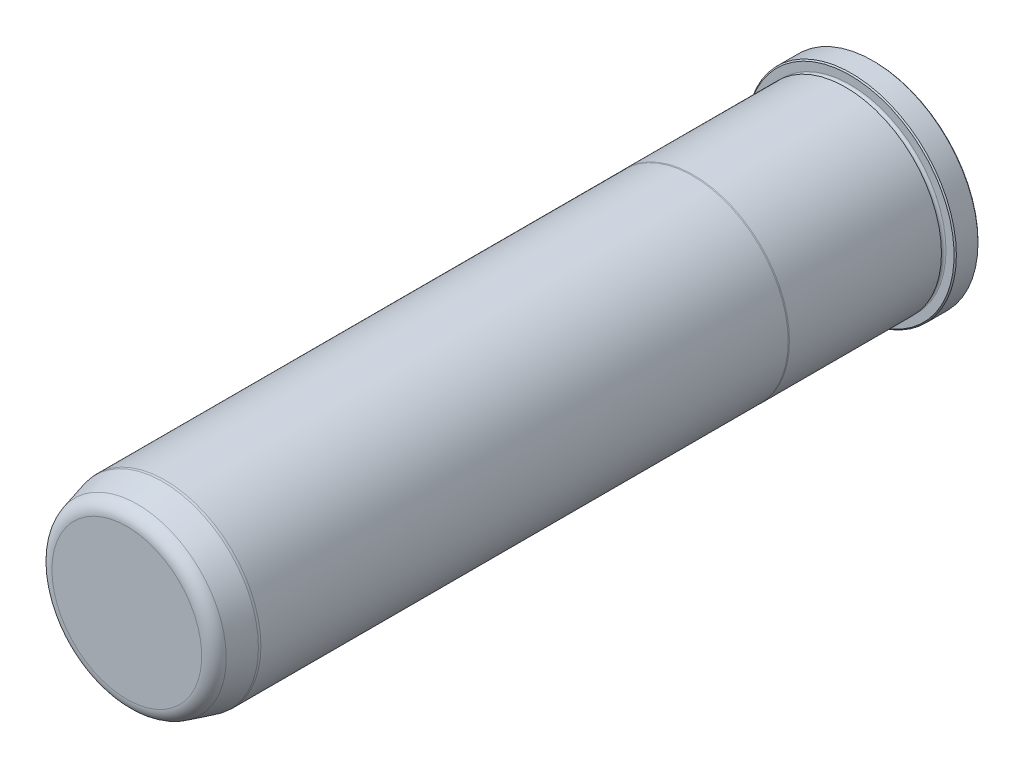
SolidWorks part; units mm, degrees
ref_plane "Front Plane" through (0, 0, 0) normal (0, 0, 1) x (1, 0, 0)
ref_plane "Top Plane" through (0, 0, 0) normal (0, 1, 0) x (1, 0, 0)
ref_plane "Right Plane" through (0, 0, 0) normal (1, 0, 0) x (0, 0, -1)
sketch "Sketch1" plane through (0, 0, 0) normal (1, 0, 0) x (0, 0, -1)
  line L0 (0, 0) -> (0, 34.798)
  line L1 (0, 34.798) -> (-7.9248, 34.798)
  line L2 (-7.9248, 34.798) -> (-7.9248, 31.7373)
  line L3 (-7.9248, 30.9753) -> (-9.4488, 30.9753) construction
  line L4 (-9.4488, 31.7373) -> (-9.4488, 31.7627)
  line L5 (-9.4488, 31.7627) -> (-59.8348, 31.7627)
  line L6 (-59.8348, 31.7627) -> (-60.198, 31.7373)
  line L7 (-60.198, 31.7373) -> (-234.95, 31.7373)
  line L9 (-247.65, 28.4719) -> (-247.65, 0)
  line L10 (-247.65, 0) -> (0, 0)
  line L11 (0, 0) -> (13.6287, 0) construction
  line L12 (-234.95, 31.7373) -> (-235.712, 31.6706)
  line L13 (-235.712, 31.6706) -> (-247.65, 28.4719)
  arc A0 (-9.4488, 31.7373) -> (-7.9248, 31.7373) centre (-8.6868, 31.7373) ccw
  dimension "D14" = 1.524
  dimension "D1" = 7.9248
  dimension "D2" = 1.524
  dimension "D3" = 69.596
  dimension "D4" = 63.5254
  dimension "D5" = 60.198
  dimension "D6" = 247.65
  dimension "D7" = 0.7874
  dimension "D8" = 4
  dimension "D9" = 63.4746
  dimension "D10" = 5
  dimension "D11" = 15
  dimension "D12" = 0.762
  dimension "D13" = 12.7
revolve "Revolve1" add sketch "Sketch1" angle 360 about L11
fillet "Fillet6" radius 4.7625 1 edges at (28.4719, 0, 247.65)
chamfer "Chamfer1" distance 0.381 angle 45 2 edges at (34.798, 0, 0) (34.798, 0, 7.9248)
